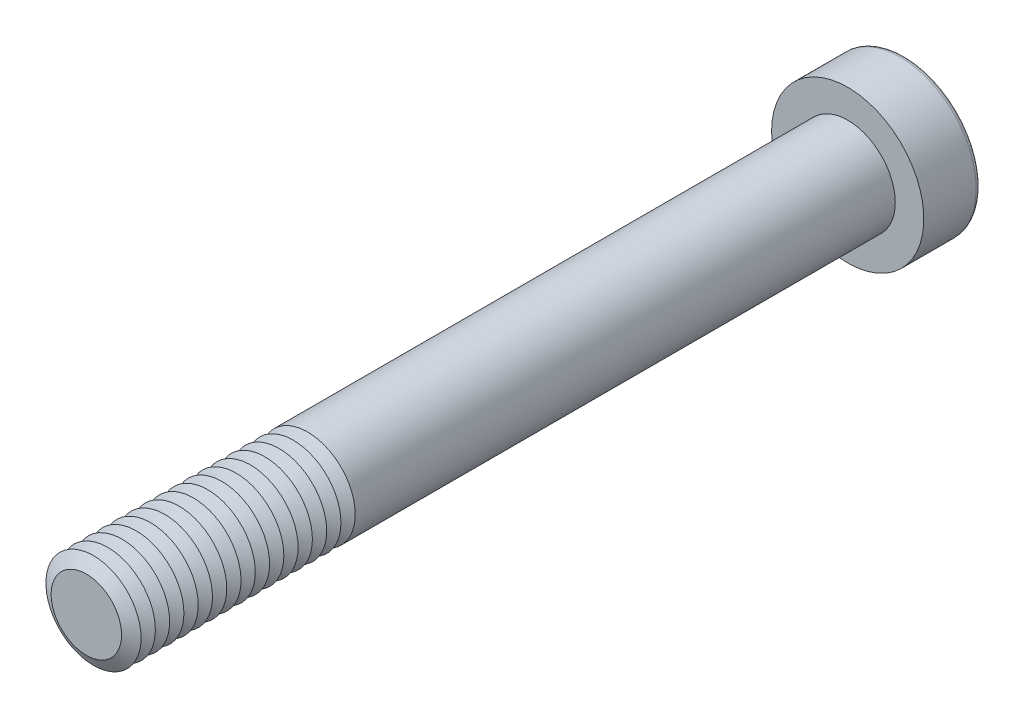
SolidWorks part; units mm, degrees
ref_plane "Front Plane" through (0, 0, 0) normal (0, 0, 1) x (1, 0, 0)
ref_plane "Top Plane" through (0, 0, 0) normal (0, 1, 0) x (1, 0, 0)
ref_plane "Right Plane" through (0, 0, 0) normal (1, 0, 0) x (0, 0, -1)
sketch "Sketch1" plane through (0, 0, 0) normal (0, 0, 1) x (1, 0, 0)
  circle A0 centre (0, 0) radius 5
  dimension "D1" = 10
extrude "Boss-Extrude1" add sketch "Sketch1" along normal blind 80
sketch "Sketch2" plane through (0, 0, 0) normal (0, 0, -1) x (-1, 0, 0)
  circle A0 centre (0, 0) radius 8
  dimension "D1" = 16
extrude "Boss-Extrude2" add sketch "Sketch2" along normal blind 6
sketch "Sketch3" plane through (0, 0, -6) normal (0, 0, -1) x (-1, 0, 0)
  line L1 (-2.0207, 3.5) -> (-4.0415, 0)
  line L2 (-4.0415, 0) -> (-2.0207, -3.5)
  line L3 (-2.0207, -3.5) -> (2.0207, -3.5)
  line L4 (2.0207, -3.5) -> (4.0415, 0)
  line L5 (4.0415, 0) -> (2.0207, 3.5)
  line L6 (2.0207, 3.5) -> (-2.0207, 3.5)
  circle A0 centre (0, 0) radius 3.5 construction
  dimension "D1" = 7
extrude "Cut-Extrude1" cut sketch "Sketch3" against normal blind 5.25
fillet "Fillet1" radius 0.5 1 edges at (-8, 0, -6)
sketch "Sketch4" plane through (0, 0, -0.75) normal (0, 0, -1) x (-1, 0, 0)
  line L0 (2.0207, -3.5) -> (4.0415, 0) construction
  circle A0 centre (0, 0) radius 3.5
extrude "Cut-Extrude2" cut sketch "Sketch4" against normal through all draft 60
sketch "Sketch5" plane through (0, 0, -6) normal (0, 0, -1) x (-1, 0, 0)
  circle A0 centre (0, 0) radius 4.0415
extrude "Cut-Extrude3" cut sketch "Sketch5" against normal through all draft 75
sketch "Sketch7" plane through (0, 0, 0) normal (1, 0, 0) x (0, 0, -1)
  line L25 (-80, 3.701) -> (-79.25, 5)
  line L26 (-80, 5) -> (-80, -5) construction
  line L27 (-79.25, 5) -> (-80.75, 5)
  line L28 (-80.75, 5) -> (-80, 3.701)
  line L29 (0, 5) -> (-80, 5) construction
  dimension "D1" = 1.5
revolve "Cut-Revolve1" cut sketch "Sketch7" angle 360 about axis through (0, 0, 80) along (0, 0, -1)
pattern_linear "LPattern1" count 16 spacing 1.5 along (0, 0, -1) of "Cut-Revolve1"
